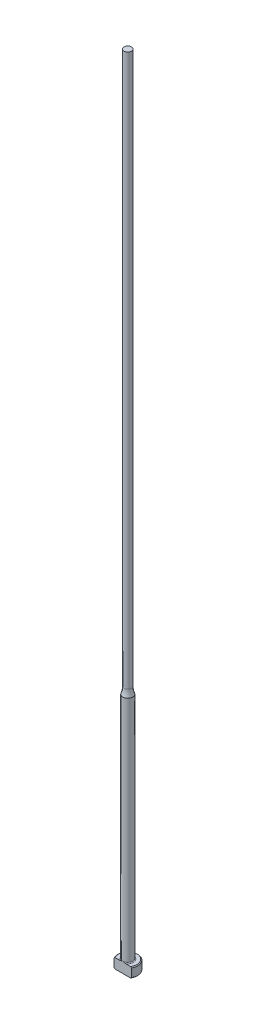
SolidWorks part; units mm, degrees
ref_plane "Front Plane" through (0, 0, 0) normal (0, 0, 1) x (1, 0, 0)
ref_plane "Top Plane" through (0, 0, 0) normal (0, 1, 0) x (1, 0, 0)
ref_plane "Right Plane" through (0, 0, 0) normal (1, 0, 0) x (0, 0, -1)
sketch "Sketch1" plane through (0, 0, 0) normal (0, 0, 1) x (1, 0, 0)
  line L0 (0, 259.9588) -> (0, -15.1925) construction
  line L1 (0, 0) -> (-3.175, 0)
  line L2 (-3.175, 0) -> (-3.175, 3.175)
  line L3 (-3.175, 3.175) -> (-1.5875, 3.175)
  line L4 (-1.19, 78.4114) -> (-1.19, 254)
  line L5 (-1.19, 254) -> (0, 254)
  line L6 (0, 254) -> (0, 0)
  line L7 (-1.5875, 3.175) -> (-1.5875, 76.2)
  arc A0 (-1.5875, 76.2) -> (-1.19, 78.4114) centre (-7.54, 78.4114) ccw
  point P13 (-1.5875, 0)
  dimension "D1" = 6.35
  dimension "L" = 254
  dimension "D2" = 3.175
  dimension "H" = 6.35
  dimension "T" = 3.175
  dimension "D" = 2.38
  dimension "S" = 76.2
revolve "Revolve1" add sketch "Sketch1" angle 360 about L0
chamfer "Chamfer1" distance 0.254 angle 45 2 edges at (0, 3.175, 3.175) (0, 0, 3.175)
fillet "Fillet1" radius 0.254 1 edges at (0, 3.175, 1.5875)
sketch "Sketch2" plane through (0, 0, 0) normal (0, -1, 0) x (1, 0, 0)
  line L0 (-2.7496, 1.5875) -> (2.7496, 1.5875)
  circle A0 centre (0, 0) radius 3.175 construction
  arc A1 (2.7496, 1.5875) -> (-2.7496, 1.5875) centre (0, 0) ccw
  circle A4 centre (0, 0) radius 1.5875 construction
  dimension "D1" = 0
extrude "KEY" cut sketch "Sketch2" against normal through all
